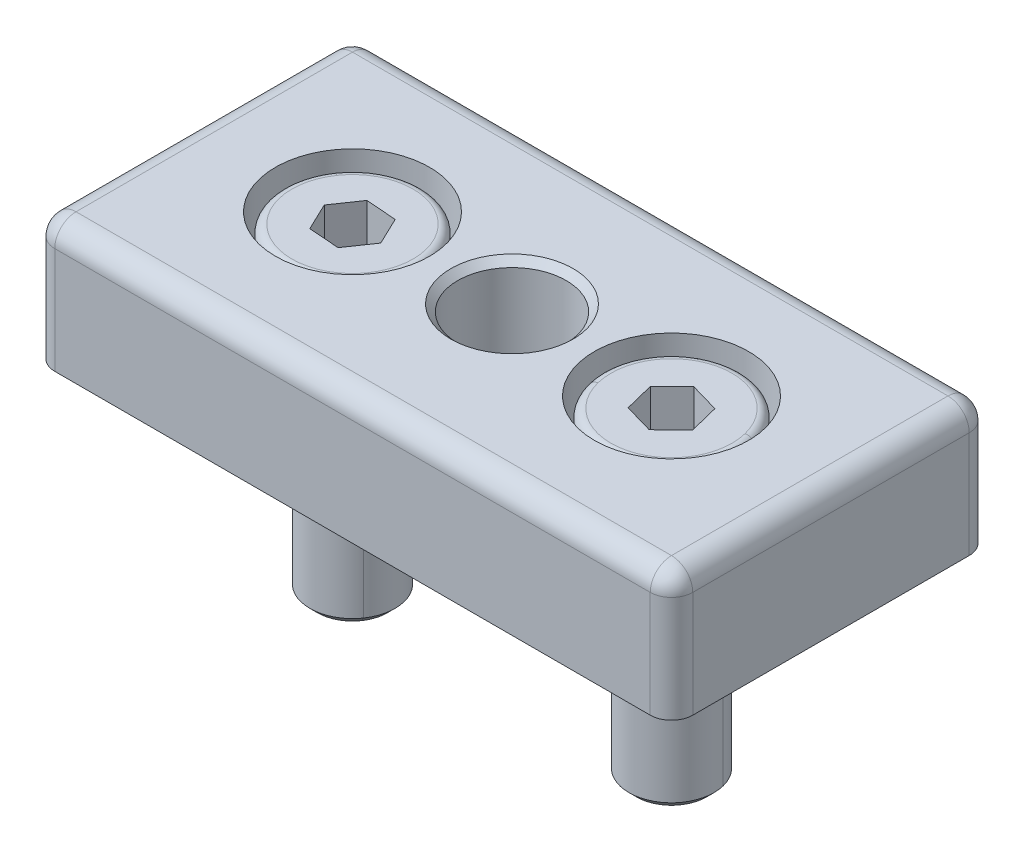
SolidWorks part; units mm, degrees
ref_plane "Front Plane" through (0, 0, 0) normal (0, 0, 1) x (1, 0, 0)
ref_plane "Top Plane" through (0, 0, 0) normal (0, 1, 0) x (1, 0, 0)
ref_plane "Right Plane" through (0, 0, 0) normal (1, 0, 0) x (0, 0, -1)
imported_body "1.5003 kierrelevy 30x60 M12-1-solid1"
imported_body "1.2087 Kuusiokoloruuvi M8x25-1-solid1"
imported_body "1.2087 Kuusiokoloruuvi M8x25-2-solid1"
sketch "Sketch1" plane through (0, -5.2909, 0) normal (0, -1, 0) x (1, 0, 0)
  line L4 (-29.3688, -15.8465) -> (26.6312, -15.8465)
  line L5 (28.6312, -13.8465) -> (28.6312, 12.1535)
  line L6 (26.6312, 14.1535) -> (-29.3688, 14.1535)
  line L7 (-31.3688, 12.1535) -> (-31.3688, -13.8465)
  line L8 (-29.3688, -15.8465) -> (26.6312, -15.8465)
  line L9 (28.6312, -13.8465) -> (28.6312, 12.1535)
  line L10 (26.6312, 14.1535) -> (-29.3688, 14.1535)
  line L11 (-31.3688, 12.1535) -> (-31.3688, -13.8465)
  circle A0 centre (13.6312, -0.8465) radius 4.5 construction
  circle A1 centre (-16.3688, -0.8465) radius 4.5 construction
  circle A2 centre (13.6312, -0.8465) radius 4.5
  circle A3 centre (-16.3688, -0.8465) radius 4.5
  arc A4 (26.6312, -15.8465) -> (28.6312, -13.8465) centre (26.6312, -13.8465) ccw
  arc A5 (28.6312, 12.1535) -> (26.6312, 14.1535) centre (26.6312, 12.1535) ccw
  arc A6 (-29.3688, 14.1535) -> (-31.3688, 12.1535) centre (-29.3688, 12.1535) ccw
  arc A7 (-31.3688, -13.8465) -> (-29.3688, -15.8465) centre (-29.3688, -13.8465) ccw
  arc A8 (26.6312, -15.8465) -> (28.6312, -13.8465) centre (26.6312, -13.8465) ccw
  arc A9 (28.6312, 12.1535) -> (26.6312, 14.1535) centre (26.6312, 12.1535) ccw
  arc A10 (-29.3688, 14.1535) -> (-31.3688, 12.1535) centre (-29.3688, 12.1535) ccw
  arc A11 (-31.3688, -13.8465) -> (-29.3688, -15.8465) centre (-29.3688, -13.8465) ccw
  dimension "D1" = 0
extrude "Cut-Extrude1" cut sketch "Sketch1" against normal blind 3.2
